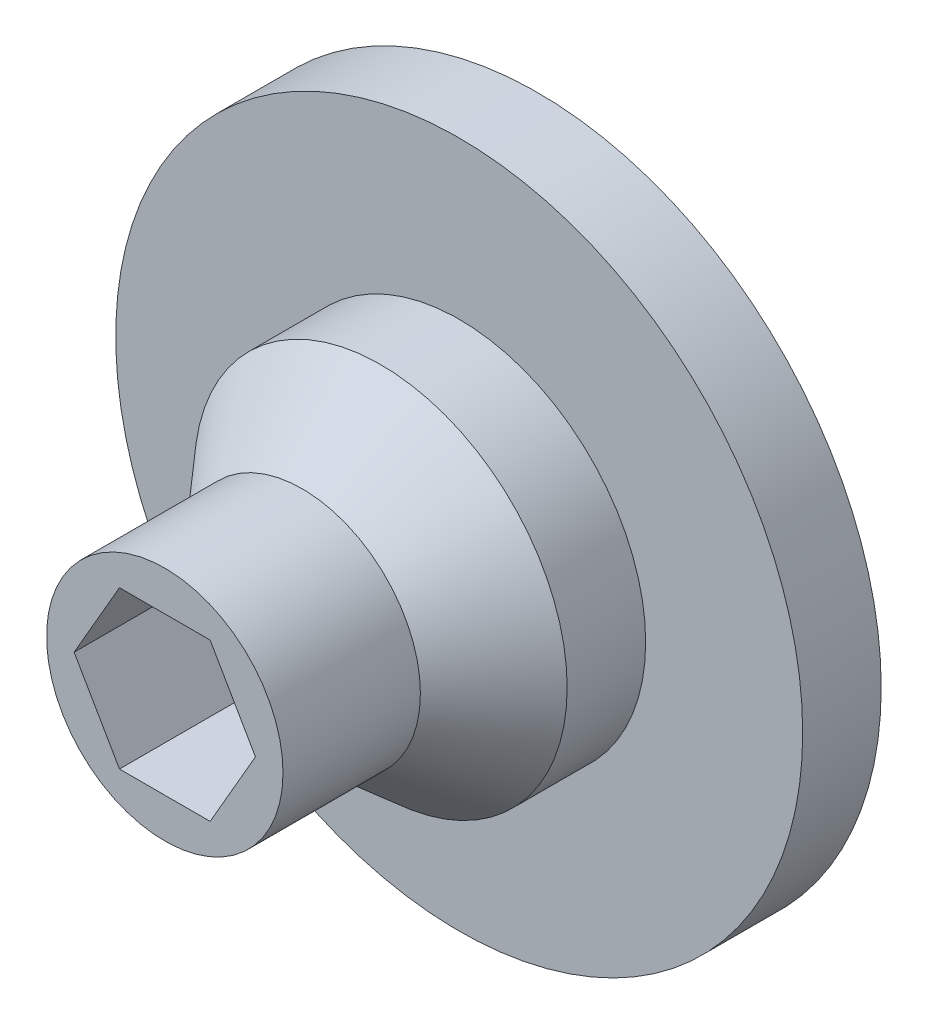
SolidWorks part; units mm, degrees
ref_plane "Plan1" through (0, 0, 0) normal (0, 0, 1) x (1, 0, 0)
ref_plane "Plan2" through (0, 0, 0) normal (0, 1, 0) x (1, 0, 0)
ref_plane "Plan3" through (0, 0, 0) normal (1, 0, 0) x (0, 0, -1)
sketch "Esquisse1" plane through (0, 0, 0) normal (0, 0, 1) x (1, 0, 0)
  line L15 (6.6421, 19.1281) -> (-4.7489, -13.676) construction
  circle A0 centre (0, 0) radius 8.75
  circle A1 centre (0, 0) radius 4.75 construction
  dimension "D1" = 17.5
  dimension "D2" = 9.5
extrude "Base-Extrusion" add sketch "Esquisse1" along normal blind 2
sketch "Esquisse3" plane through (0, 0, 2) normal (0, 0, 1) x (1, 0, 0)
  circle A0 centre (0, 0) radius 4.75
  dimension "D1" = 9.5
extrude "Boss.-Extru.1" add sketch "Esquisse3" along normal blind 2
sketch "Esquisse4" plane through (0, 0, 4) normal (0, 0, 1) x (1, 0, 0)
  circle A1 centre (0, 0) radius 4.75
  circle A2 centre (0, 0) radius 4.75
  dimension "D1" = 0
extrude "Boss.-Extru.2" add sketch "Esquisse4" along normal blind 2 draft 41
sketch "Esquisse5" plane through (0, 0, 6) normal (0, 0, 1) x (1, 0, 0)
  circle A1 centre (0, 0) radius 3.0114
  circle A2 centre (0, 0) radius 3.0114
  dimension "D1" = 0
extrude "Boss.-Extru.3" add sketch "Esquisse5" along normal blind 3.5
sketch "Esquisse6" plane through (0, 0, 9.5) normal (0, 0, -1) x (-1, 0, 0)
  line L0 (0, 7) -> (0, -8) construction
  line L1 (3.6749, 6.3651) -> (-3.6749, -6.3651) construction
  line L2 (4.7176, -2.7237) -> (-4.7176, 2.7237) construction
  line L3 (1.1547, 2) -> (-1.1547, 2)
  line L4 (-1.1547, 2) -> (-2.3094, 0)
  line L5 (-1.1547, -2) -> (-2.3094, 0)
  line L6 (1.1547, 2) -> (2.3094, 0)
  line L7 (2.3094, 0) -> (1.1547, -2)
  line L8 (-1.1547, -2) -> (1.1547, -2)
  line L9 (0, 0) -> (-1.1547, 2) construction
  line L10 (0, 0) -> (-2.3094, 0) construction
  point P11 (-1.7321, 1)
  dimension "D1" = 30
  dimension "D2" = 60
  dimension "D3" = 120
  dimension "D4" = 4
extrude "Enlèv. mat.-Extru.1" cut sketch "Esquisse6" along normal through all
